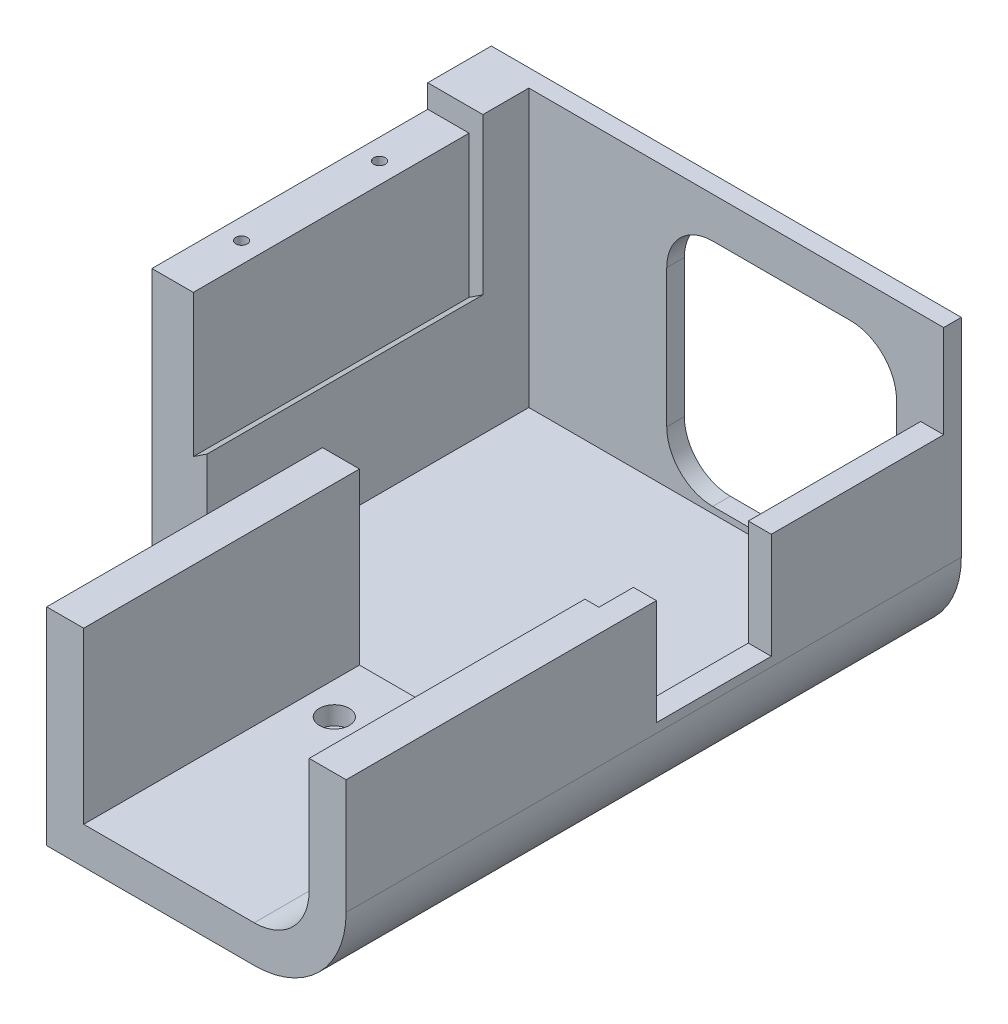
SolidWorks part; units mm, degrees
ref_plane "Front Plane" through (0, 0, 0) normal (0, 0, 1) x (1, 0, 0)
ref_plane "Top Plane" through (0, 0, 0) normal (0, 1, 0) x (1, 0, 0)
ref_plane "Right Plane" through (0, 0, 0) normal (1, 0, 0) x (0, 0, -1)
sketch "Sketch2" plane through (0, 0, 0) normal (0, 0, 1) x (1, 0, 0)
  line L0 (85.25, 15) -> (85.25, 45.2)
  line L1 (70.25, 60.2) -> (0, 60.2)
  line L2 (0, 60.2) -> (0, 33.96)
  line L3 (0, 33.96) -> (-3, 35.94)
  line L4 (-3, 35.94) -> (-3, 24.26)
  line L6 (-3, 24.26) -> (0, 26.24)
  line L7 (0, 26.24) -> (0, 0)
  line L8 (0, 0) -> (70.25, 0)
  line L9 (30, 41.37) -> (30, 11.37)
  line L10 (40, 1.37) -> (70, 1.37)
  line L11 (80, 11.37) -> (80, 41.37)
  line L12 (70, 51.37) -> (40, 51.37)
  arc A0 (70.25, 0) -> (85.25, 15) centre (70.25, 15) ccw
  arc A1 (85.25, 45.2) -> (70.25, 60.2) centre (70.25, 45.2) ccw
  arc A2 (30, 11.37) -> (40, 1.37) centre (40, 11.37) ccw
  arc A3 (70, 1.37) -> (80, 11.37) centre (70, 11.37) ccw
  arc A4 (80, 41.37) -> (70, 51.37) centre (70, 41.37) ccw
  arc A5 (40, 51.37) -> (30, 41.37) centre (40, 41.37) ccw
  point P13 (0, 0)
  point P14 (0, 0)
  point P16 (0, 0)
  point P17 (0, 0)
  point P18 (0, 0)
  dimension "D3" = 15
  dimension "D4" = 3
  dimension "D7" = 10
  dimension "D1" = 85.25
  dimension "D2" = 60.2
  dimension "D5" = 11.68
  dimension "D6" = 7.72
  dimension "D8" = 50
  dimension "D9" = 50
  dimension "D10" = 5.25
  dimension "D11" = 1.37
ref_plane "Plane1" through (0, 0, 70) normal (0, 0, 1) x (1, 0, 0)
sketch "Sketch4" plane through (0, 0, 70) normal (0, 0, 1) x (1, 0, 0)
  line L0 (82.2, 15) -> (82.2, 45.2)
  line L1 (70.25, 57.15) -> (33.15, 57.15)
  line L2 (33.15, 57.15) -> (33.15, 3.05)
  line L3 (33.15, 3.05) -> (70.25, 3.05)
  line L4 (85.25, 15) -> (85.25, 45.2) construction
  line L5 (0, 0) -> (70.25, 0) construction
  arc A0 (82.2, 45.2) -> (70.25, 57.15) centre (70.25, 45.2) ccw
  arc A1 (70.25, 3.05) -> (82.2, 15) centre (70.25, 15) ccw
  point P8 (0, 0)
  point P9 (68.4273, 44.8027)
  dimension "D3" = 11.95
  dimension "D1" = 54.1
  dimension "D2" = 49.05
  dimension "D4" = 3.05
  dimension "D5" = 3.05
sketch "Sketch3" plane through (0, 0, 0) normal (0, 0, 1) x (1, 0, 0)
  line L0 (85.25, 15) -> (85.25, 45.2) construction
  line L1 (0, 0) -> (70.25, 0) construction
  line L2 (0, 26.24) -> (0, 0) construction
  line L5 (85.25, 15) -> (85.25, 40)
  line L6 (0, 0) -> (70.25, 0)
  line L7 (0, 60.2) -> (0, 0)
  line L10 (0, 60.2) -> (-12, 60.2)
  line L11 (-12, -5) -> (70.25, -5)
  line L12 (90.25, 15) -> (90.25, 40)
  line L13 (0, -5) -> (70.25, -5) construction
  line L14 (-12, 60.2) -> (-12, -5)
  line L15 (85.25, 40) -> (90.25, 40)
  arc A0 (70.25, 0) -> (85.25, 15) centre (70.25, 15) ccw construction
  arc A1 (70.25, 0) -> (85.25, 15) centre (70.25, 15) ccw
  arc A2 (70.25, -5) -> (90.25, 15) centre (70.25, 15) ccw
  point P6 (0, 60.2)
  point P16 (0, 0)
  dimension "D1" = 5
  dimension "D2" = 40
  dimension "D3" = 12
extrude "Boss-Extrude1" add sketch "Sketch3" along normal up to surface (70 mm away)
sketch "Sketch5" plane through (0, 0, 70) normal (0, 0, 1) x (1, 0, 0)
  line L0 (82.2, 15) -> (82.2, 45.2) construction
  line L1 (33.15, 3.05) -> (70.25, 3.05) construction
  line L2 (33.15, 57.15) -> (33.15, 3.05) construction
  line L3 (82.2, 15) -> (82.2, 40)
  line L4 (33.15, 3.05) -> (70.25, 3.05)
  line L5 (33.15, 40) -> (33.15, 3.05)
  line L6 (25.1, 40) -> (25.1, -5)
  line L7 (25.1, -5) -> (70.25, -5)
  line L8 (90.25, 15) -> (90.25, 40)
  line L9 (33.15, 57.15) -> (33.15, 3.05) construction
  line L10 (25.1, 57.15) -> (25.1, -5) construction
  line L11 (25.1, 40) -> (33.15, 40)
  line L12 (82.2, 40) -> (90.25, 40)
  arc A0 (70.25, 3.05) -> (82.2, 15) centre (70.25, 15) ccw construction
  arc A1 (70.25, 3.05) -> (82.2, 15) centre (70.25, 15) ccw
  arc A2 (70.25, -5) -> (90.25, 15) centre (70.25, 15) ccw
  point P4 (0, 0)
  point P9 (0, 0)
  dimension "D1" = 8.05
extrude "Boss-Extrude2" add sketch "Sketch5" along normal blind 60
sketch "Sketch6" plane through (0, 0, 70) normal (0, 0, 1) x (1, 0, 0)
  line L0 (-3, 24.26) -> (0, 26.24) construction
  line L1 (-3, 35.94) -> (-3, 24.26) construction
  line L2 (-3, 24.26) -> (0, 26.24)
  line L3 (-3, 60.2) -> (-3, 24.26)
  line L4 (0, 60.2) -> (-12, 60.2) construction
  line L5 (0, 26.24) -> (0, 60.2)
  line L6 (0, 60.2) -> (-3, 60.2)
extrude "Cut-Extrude1" cut sketch "Sketch6" against normal offset from surface (60 mm away) 10
sketch "Sketch7" plane through (0, 0, 0) normal (0, 0, 1) x (1, 0, 0)
  line L0 (70, 51.37) -> (40, 51.37) construction
  line L1 (30, 41.37) -> (30, 11.37) construction
  line L2 (40, 1.37) -> (70, 1.37) construction
  line L3 (80, 11.37) -> (80, 41.37) construction
  line L4 (70, 51.37) -> (40, 51.37)
  line L5 (30, 41.37) -> (30, 11.37)
  line L6 (40, 1.37) -> (70, 1.37)
  line L7 (80, 11.37) -> (80, 41.37)
  line L8 (-12, 60.2) -> (-12, -5) construction
  line L9 (-12, -5) -> (70.25, -5) construction
  line L10 (90.25, 15) -> (90.25, 40) construction
  line L11 (-12, 60.2) -> (-12, -5)
  line L12 (-12, -5) -> (70.25, -5)
  line L13 (90.25, 15) -> (90.25, 60.2)
  line L14 (0, 60.2) -> (-12, 60.2) construction
  line L15 (90.25, 60.2) -> (-12, 60.2)
  arc A0 (80, 41.37) -> (70, 51.37) centre (70, 41.37) ccw construction
  arc A1 (40, 51.37) -> (30, 41.37) centre (40, 41.37) ccw construction
  arc A2 (30, 11.37) -> (40, 1.37) centre (40, 11.37) ccw construction
  arc A3 (70, 1.37) -> (80, 11.37) centre (70, 11.37) ccw construction
  arc A4 (80, 41.37) -> (70, 51.37) centre (70, 41.37) ccw
  arc A5 (40, 51.37) -> (30, 41.37) centre (40, 41.37) ccw
  arc A6 (30, 11.37) -> (40, 1.37) centre (40, 11.37) ccw
  arc A7 (70, 1.37) -> (80, 11.37) centre (70, 11.37) ccw
  arc A8 (70.25, -5) -> (90.25, 15) centre (70.25, 15) ccw construction
  arc A9 (70.25, -5) -> (90.25, 15) centre (70.25, 15) ccw
  point P16 (91.25, 60.2)
  point P21 (0, 0)
  point P22 (92.0175, 60.2)
extrude "Boss-Extrude3" add sketch "Sketch7" against normal blind 3.84
hole_wizard "CBORE for M3 SHCS1" positions "Sketch10" profile "Sketch11" counterbore size "M3" standard "ANSI Metric"
sketch "Sketch10" plane through (0, 3.05, 0) normal (0, 1, 0) x (1, 0, 0)
  line L1 (25.1, -70) -> (70.25, -70) construction
  line L2 (25.1, -70) -> (25.1, -95) construction
  line L3 (25.1, -95) -> (70.25, -95) construction
  line L4 (70.25, -70) -> (70.25, -95) construction
  line L5 (40.175, -82.5) -> (55.175, -82.5) construction
  line L8 (70.25, -130) -> (70.25, -70) construction
  point P0 (40.175, -82.5)
  point P2 (55.175, -82.5)
  point P53 (0, 0)
  point P57 (0, 0)
  point P58 (25.1, -82.5)
  point P59 (47.675, -82.5)
  point P60 (47.675, -95)
  point P61 (0, 0)
  point P62 (0, 0)
  dimension "D1" = 15
  dimension "D2" = 45.15
  dimension "D3" = 25
sketch "Sketch11" plane through (40.175, 3.05, 82.5) normal (1, 0, 0) x (0, 0, 1)
  line L0 (0, 0) -> (0, 9.0715)
  line L1 (0, 9.0715) -> (1.7, 8.05)
  line L2 (1.7, 8.05) -> (1.7, 4)
  line L3 (1.7, 4) -> (3.25, 4)
  line L4 (3.25, 4) -> (3.25, 0)
  line L5 (3.25, 0) -> (0, 0)
  line L10 (0, 9.0715) -> (-1.7, 8.05) construction
  line L11 (0, -6.35) -> (0, 107.95) construction
  dimension "Hole Dia." = 3.4
  dimension "Hole Depth" = 8.05
  dimension "C'Bore Dia." = 6.5
  dimension "C'Bore Depth" = 4
  dimension "Drill Angle" = 118
sketch "Sketch12" plane through (90.25, 0, 0) normal (1, 0, 0) x (0, 0, -1)
  line L0 (-70, 35.86) -> (-70, -35.86) construction
  line L2 (-62.5, 17) -> (-37.5, 17)
  line L3 (-62.5, 17) -> (-62.5, 40)
  line L4 (-62.5, 40) -> (-37.5, 40)
  line L5 (-37.5, 17) -> (-37.5, 40)
  line L9 (0, 15) -> (0, 45.2) construction
  line L10 (-130, 40) -> (0, 40) construction
  circle A0 centre (-50, 30.1) radius 7.5 construction
  point P8 (0, 0)
  point P10 (0, 0)
  point P13 (0, 30.1)
  point P15 (0, 0)
  point P16 (-38.8584, 17.7859)
  point P17 (-50, 40)
  dimension "D1" = 15
  dimension "D2" = 20
  dimension "D3" = 25
  dimension "D4" = 23
extrude "Cut-Extrude2" cut sketch "Sketch12" against normal up to surface (5 mm away)
sketch "Sketch13" plane through (0, 60.2, 0) normal (0, 1, 0) x (1, 0, 0)
  line L0 (-35.86, -70) -> (35.86, -70) construction
  line L1 (-3, -10) -> (-12, -10)
  line L2 (-3, -10) -> (-3, -70)
  line L3 (-3, -70) -> (-12, -70)
  line L4 (-12, -10) -> (-12, -70)
  line L5 (-12, -70) -> (-12, 3.84) construction
extrude "Cut-Extrude3" cut sketch "Sketch13" against normal blind 5
hole_wizard "M3x0.5 Tapped Hole1" positions "Sketch14" profile "Sketch15" tap size "M3x0.5" standard "ANSI Metric"
sketch "Sketch14" plane through (0, 55.2, 0) normal (0, 1, 0) x (1, 0, 0)
  line L0 (-7.5, -25) -> (-7.5, -55) construction
  line L2 (-12, -10) -> (-12, -70) construction
  line L3 (-3, -10) -> (-12, -10) construction
  point P0 (-7.5, -25)
  point P2 (-7.5, -55)
  point P11 (-12, -40)
  point P12 (-7.5, -40)
  point P15 (-7.5, -10)
  dimension "D1" = 30
sketch "Sketch15" plane through (-7.5, 55.2, 25) normal (1, 0, 0) x (0, 0, 1)
  line L0 (0, 0) -> (0, 8.7511)
  line L1 (0, 8.7511) -> (1.25, 8)
  line L2 (1.25, 8) -> (1.25, 0)
  line L5 (1.25, 0) -> (0, 0)
  line L10 (0, 8.7511) -> (-1.25, 8) construction
  line L11 (0, -6.35) -> (0, 107.95) construction
  dimension "Tap Drill Dia." = 2.5
  dimension "Tap Drill Depth" = 8
  dimension "Drill Angle" = 118
